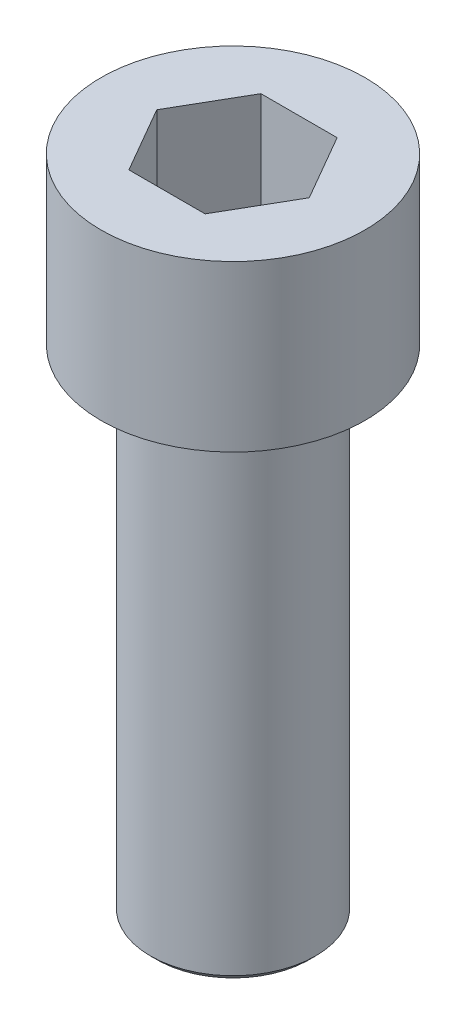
SolidWorks part; units mm, degrees
ref_plane "Front Plane" through (0, 0, 0) normal (0, 0, 1) x (1, 0, 0)
ref_plane "Top Plane" through (0, 0, 0) normal (0, 1, 0) x (1, 0, 0)
ref_plane "Right Plane" through (0, 0, 0) normal (1, 0, 0) x (0, 0, -1)
sketch "Sketch1" plane through (0, 0, 0) normal (0, 0, 1) x (1, 0, 0)
  line L0 (0, 0) -> (0, 135.6354) construction
  line L1 (0, 0) -> (15, 0)
  line L2 (15, 0) -> (15, 90)
  line L3 (15, 90) -> (24, 90)
  line L4 (24, 90) -> (24, 120)
  line L5 (24, 120) -> (0, 120)
  line L6 (0, 120) -> (0, 0)
  dimension "D1" = 30
  dimension "D2" = 48
  dimension "D3" = 30
  dimension "D4" = 90
revolve "Revolve1" add sketch "Sketch1" angle 360 about L0
sketch "Sketch2" plane through (0, 120, 0) normal (0, 1, 0) x (1, 0, 0)
  line L1 (13.8564, 0) -> (6.9282, 12)
  line L2 (6.9282, 12) -> (-6.9282, 12)
  line L3 (-6.9282, 12) -> (-13.8564, 0)
  line L4 (-13.8564, 0) -> (-6.9282, -12)
  line L5 (-6.9282, -12) -> (6.9282, -12)
  line L6 (6.9282, -12) -> (13.8564, 0)
  circle A0 centre (0, 0) radius 12 construction
  point P1 (0, 12)
  dimension "D1" = 24
extrude "Extrude1" cut sketch "Sketch2" against normal blind 18
chamfer "Chamfer1" distance 1.2 angle 45 1 edges at (0, 0, -15)
fillet "Fillet1" radius 1.2 1 edges at (0, 90, -15)
equation "\"D3@Sketch1\" = \"D1@Sketch1\"  ' Head thick"
equation "\"D2@Sketch1\" = \"D1@Sketch1\" * 1.6 ' Head dia "
equation "\"D1@Sketch2\" = \"D1@Sketch1\" * .8 ' Hexagon"
equation "\"D1@Extrude1\" = \"D1@Sketch1\" * .6 ' Hexagon depth"
equation "\"D1@Fillet1\" = \"D1@Sketch1\" * .04 ' Fillet"
equation "\"D1@Chamfer1\" = \"D1@Sketch1\" * .04 ' Chamfer"
equation "\"D4@Sketch1\" = \"D1@Sketch1\" * 3 ' Screw Length"
